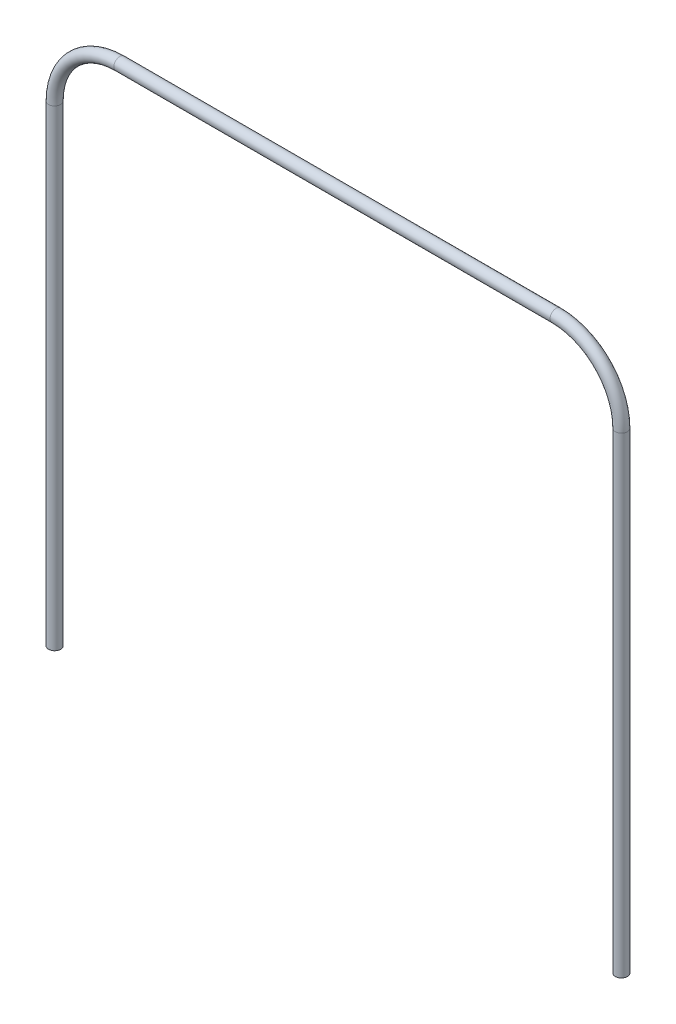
SolidWorks part; units mm, degrees
ref_plane "Plan1" through (0, 0, 0) normal (0, 0, 1) x (1, 0, 0)
ref_plane "Plan2" through (0, 0, 0) normal (0, 1, 0) x (1, 0, 0)
ref_plane "Plan3" through (0, 0, 0) normal (1, 0, 0) x (0, 0, -1)
sketch "Esquisse1" plane through (0, 0, 0) normal (0, 0, 1) x (1, 0, 0)
  line L0 (0, 0) -> (0, 470)
  line L1 (65, 535) -> (499.55, 535)
  line L2 (564.55, 470) -> (564.55, 0)
  arc A0 (499.55, 535) -> (564.55, 470) centre (499.55, 470) cw
  arc A1 (0, 470) -> (65, 535) centre (65, 470) cw
  point P7 (564.55, 535)
  point P10 (0, 535)
  dimension "D3" = 65
  dimension "D4" = 65
  dimension "D1" = 564.55
  dimension "D2" = 535
sketch "Esquisse2" plane through (0, 0, 0) normal (0, 1, 0) x (1, 0, 0)
  circle A0 centre (0, 0) radius 6
  dimension "D1" = 12
sweep "Base-Balayage" add profiles "Esquisse2" path "Esquisse1"
